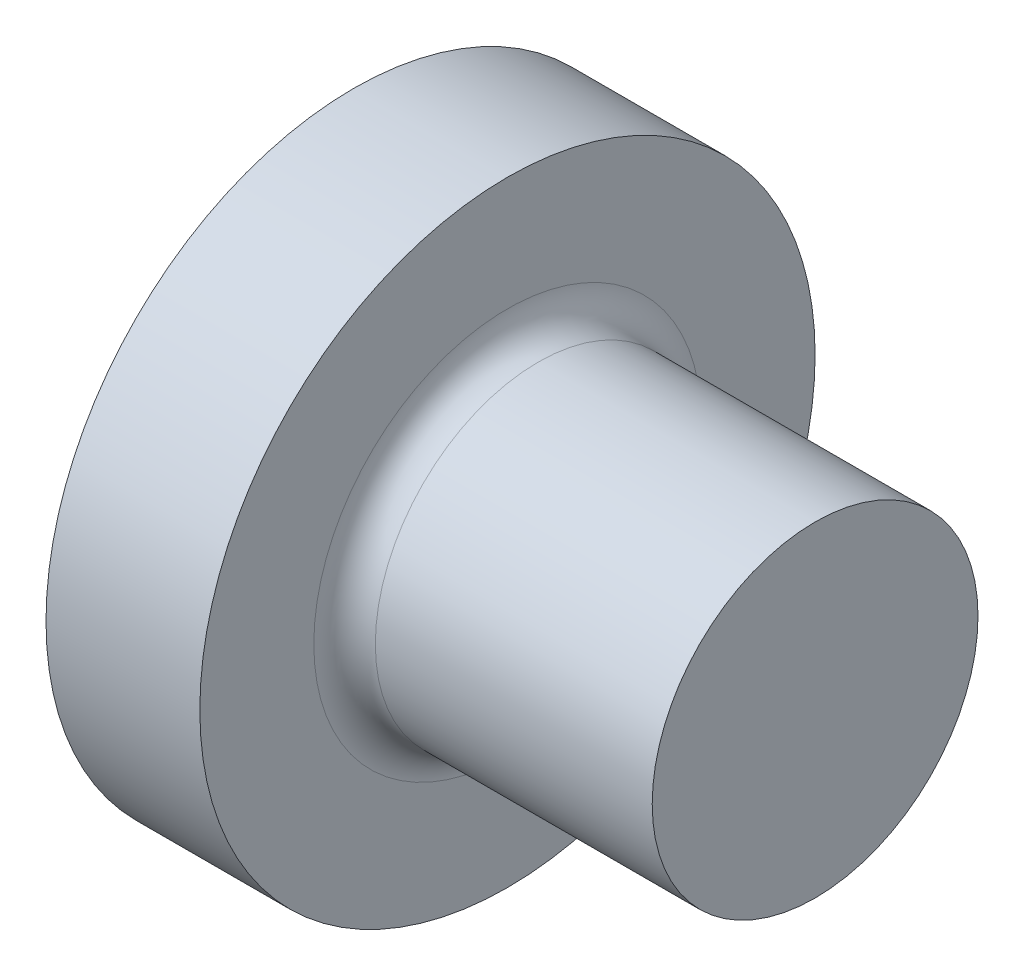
SolidWorks part; units mm, degrees
ref_plane "Front Plane" through (0, 0, 0) normal (0, 0, 1) x (1, 0, 0)
ref_plane "Top Plane" through (0, 0, 0) normal (0, 1, 0) x (1, 0, 0)
ref_plane "Right Plane" through (0, 0, 0) normal (1, 0, 0) x (0, 0, -1)
sketch "Sketch1" plane through (0, 0, 0) normal (0, 0, 1) x (1, 0, 0)
  line L0 (0, 0.7497) -> (0, 13.4497)
  line L1 (0, 13.4497) -> (-22.86, 13.4497)
  line L2 (-25.4, 15.9897) -> (-25.4, 25.4)
  line L3 (-25.4, 25.4) -> (-38.1, 25.4)
  line L4 (-38.1, 25.4) -> (-38.1, 0)
  line L5 (-38.1, 0) -> (0, 0)
  line L6 (52.5109, 0) -> (-70.253, 0) construction
  line L7 (0, 0.7497) -> (0, 0)
  arc A0 (-22.86, 13.4497) -> (-25.4, 15.9897) centre (-22.86, 15.9897) cw
  point P10 (-25.4, 13.4497)
  dimension "D5" = 2.54
  dimension "D1" = 12.7
  dimension "D2" = 25.4
  dimension "D3" = 25.4
  dimension "D4" = 38.1
revolve "Revolve1" add sketch "Sketch1" angle 360 about L6
